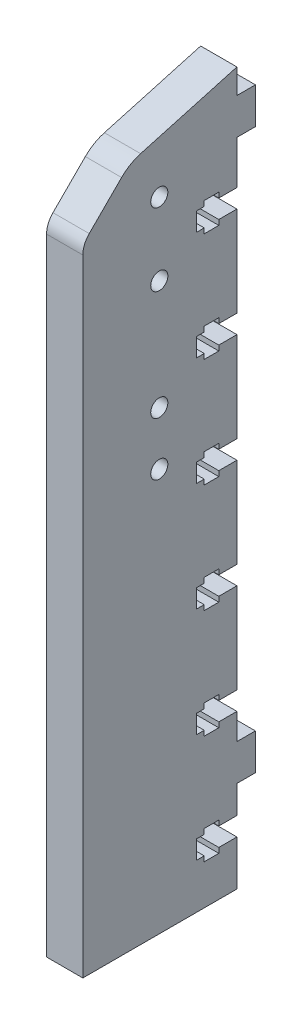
SolidWorks part; units mm, degrees
ref_plane "Front Plane" through (0, 0, 0) normal (0, 0, 1) x (1, 0, 0)
ref_plane "Top Plane" through (0, 0, 0) normal (0, 1, 0) x (1, 0, 0)
ref_plane "Right Plane" through (0, 0, 0) normal (1, 0, 0) x (0, 0, -1)
sketch "Sketch1" plane through (0, 0, 0) normal (0, 0, 1) x (1, 0, 0)
  line L1 (0, 0) -> (-12.7, 0)
  line L2 (0, 0) -> (0, 276.4592)
  line L3 (0, 276.4592) -> (-12.7, 276.4592)
  line L4 (-12.7, 0) -> (-12.7, 276.4592)
  dimension "D1" = 12.7
  dimension "D2" = 276.4592
extrude "Boss-Extrude1" add sketch "Sketch1" along normal blind 53.975
sketch "Sketch2" plane through (0, 0, 0) normal (1, 0, 0) x (0, 0, -1)
  line L0 (0, 276.4592) -> (-53.975, 222.4842)
  line L1 (-53.975, 0) -> (-53.975, 276.4592) construction
  line L2 (-53.975, 222.4842) -> (-53.975, 276.4592)
  line L3 (-53.975, 276.4592) -> (0, 276.4592)
extrude "Cut-Extrude1" cut sketch "Sketch2" against normal through all
fillet "Fillet1" radius 7.62 2 edges at (-6.35, 222.4842, 53.975) (-6.35, 276.4592, 0)
sketch "Sketch4" plane through (-12.7, 0, 0) normal (-1, 0, 0) x (0, 0, 1)
  circle A0 centre (27.1954, 223.5186) radius 3
  circle A1 centre (27.1954, 198.1186) radius 3
  circle A2 centre (27.1954, 159.6376) radius 3
  circle A3 centre (27.1954, 140.9686) radius 3
  dimension "D1" = 6
extrude "Cut-Extrude2" cut sketch "Sketch4" against normal through all
sketch "Sketch6" plane through (-12.7, 0, 0) normal (-1, 0, 0) x (0, 0, 1)
  line L0 (0, 15.8) -> (6.35, 15.8)
  line L1 (6.35, 15.8) -> (6.35, 14)
  line L2 (6.35, 14) -> (11.45, 14)
  line L3 (11.45, 14) -> (11.45, 15.8)
  line L4 (11.45, 15.8) -> (14.224, 15.8)
  line L5 (14.224, 15.8) -> (14.224, 22.3)
  line L6 (14.0078, 15.8) -> (0, 22.3) construction
  line L7 (7.0039, 19.05) -> (98.7784, 19.05) construction
  line L8 (11.45, 22.3) -> (14.224, 22.3)
  line L9 (11.45, 24.1) -> (11.45, 22.3)
  line L10 (6.35, 24.1) -> (11.45, 24.1)
  line L11 (0, 22.3) -> (6.35, 22.3)
  line L12 (6.35, 22.3) -> (6.35, 24.1)
  line L13 (0, 15.8) -> (0, 22.3)
  line L14 (0, 258.0629) -> (0, 0) construction
  line L15 (-6.35, 15.8) -> (0, 15.8) construction
  line L16 (0, 53.9) -> (6.35, 53.9)
  line L17 (6.35, 53.9) -> (6.35, 52.1)
  line L18 (6.35, 52.1) -> (11.45, 52.1)
  line L19 (11.45, 52.1) -> (11.45, 53.9)
  line L20 (14.224, 53.9) -> (14.224, 60.4)
  line L21 (11.45, 60.4) -> (14.224, 60.4)
  line L22 (11.45, 62.2) -> (11.45, 60.4)
  line L23 (6.35, 62.2) -> (11.45, 62.2)
  line L24 (6.35, 60.4) -> (6.35, 62.2)
  line L25 (0, 60.4) -> (6.35, 60.4)
  line L26 (0, 53.9) -> (0, 60.4)
  line L27 (0, 92) -> (6.35, 92)
  line L28 (6.35, 92) -> (6.35, 90.2)
  line L29 (6.35, 90.2) -> (11.45, 90.2)
  line L30 (11.45, 90.2) -> (11.45, 92)
  line L31 (14.224, 92) -> (14.224, 98.5)
  line L32 (11.45, 98.5) -> (14.224, 98.5)
  line L33 (11.45, 100.3) -> (11.45, 98.5)
  line L34 (6.35, 100.3) -> (11.45, 100.3)
  line L35 (6.35, 98.5) -> (6.35, 100.3)
  line L36 (0, 98.5) -> (6.35, 98.5)
  line L37 (0, 92) -> (0, 98.5)
  line L38 (0, 130.1) -> (6.35, 130.1)
  line L39 (6.35, 130.1) -> (6.35, 128.3)
  line L40 (6.35, 128.3) -> (11.45, 128.3)
  line L41 (11.45, 128.3) -> (11.45, 130.1)
  line L42 (14.224, 130.1) -> (14.224, 136.6)
  line L43 (11.45, 136.6) -> (14.224, 136.6)
  line L44 (11.45, 138.4) -> (11.45, 136.6)
  line L45 (6.35, 138.4) -> (11.45, 138.4)
  line L46 (6.35, 136.6) -> (6.35, 138.4)
  line L47 (0, 136.6) -> (6.35, 136.6)
  line L48 (0, 130.1) -> (0, 136.6)
  line L49 (0, 168.2) -> (6.35, 168.2)
  line L50 (6.35, 168.2) -> (6.35, 166.4)
  line L51 (6.35, 166.4) -> (11.45, 166.4)
  line L52 (11.45, 166.4) -> (11.45, 168.2)
  line L53 (14.224, 168.2) -> (14.224, 174.7)
  line L54 (11.45, 174.7) -> (14.224, 174.7)
  line L55 (11.45, 176.5) -> (11.45, 174.7)
  line L56 (6.35, 176.5) -> (11.45, 176.5)
  line L57 (6.35, 174.7) -> (6.35, 176.5)
  line L58 (0, 174.7) -> (6.35, 174.7)
  line L59 (0, 168.2) -> (0, 174.7)
  line L60 (0, 206.3) -> (6.35, 206.3)
  line L61 (6.35, 206.3) -> (6.35, 204.5)
  line L62 (6.35, 204.5) -> (11.45, 204.5)
  line L63 (11.45, 204.5) -> (11.45, 206.3)
  line L64 (14.224, 206.3) -> (14.224, 212.8)
  line L65 (11.45, 212.8) -> (14.224, 212.8)
  line L66 (11.45, 214.6) -> (11.45, 212.8)
  line L67 (6.35, 214.6) -> (11.45, 214.6)
  line L68 (6.35, 212.8) -> (6.35, 214.6)
  line L69 (0, 212.8) -> (6.35, 212.8)
  line L70 (0, 206.3) -> (0, 212.8)
  line L71 (11.45, 53.9) -> (14.224, 53.9)
  line L72 (11.45, 92) -> (14.224, 92)
  line L73 (11.45, 130.1) -> (14.224, 130.1)
  line L74 (11.45, 168.2) -> (14.224, 168.2)
  line L75 (11.45, 206.3) -> (14.224, 206.3)
  point P12 (14.224, 19.05)
  dimension "D1" = 5.05
  dimension "D2" = 5.1
  dimension "D3" = 14.224
  dimension "D4" = 6.5
  dimension "D5" = 6.35
  dimension "D6" = 2.774
  dimension "D8" = 38.1
  dimension "D7" = 6
extrude "Cut-Extrude3" cut sketch "Sketch6" against normal through all
sketch "Sketch7" plane through (-12.7, 0, 0) normal (-1, 0, 0) x (0, 0, 1)
  line L1 (-6.477, 228.04) -> (0, 228.04)
  line L2 (-6.477, 228.04) -> (-6.477, 240.74)
  line L3 (-6.477, 240.74) -> (0, 240.74)
  line L4 (0, 228.04) -> (0, 240.74)
  line L5 (0, 258.0629) -> (0, 212.8) construction
  line L6 (0, 53.9) -> (0, 22.3) construction
  line L7 (-6.477, 32.04) -> (0, 32.04)
  line L8 (-6.477, 32.04) -> (-6.477, 44.74)
  line L9 (-6.477, 44.74) -> (0, 44.74)
  line L10 (0, 32.04) -> (0, 44.74)
  line L12 (6.35, 212.8) -> (0, 212.8) construction
  line L14 (0, 53.9) -> (6.35, 53.9) construction
  dimension "D1" = 15.24
  dimension "D2" = 12.7
  dimension "D3" = 6.477
  dimension "D4" = 9.16
  dimension "D5" = 12.7
  dimension "D6" = 6.477
extrude "Boss-Extrude2" add sketch "Sketch7" against normal blind 12.7
sketch "Sketch8" plane through (-12.7, 0, 0) normal (-1, 0, 0) x (0, 0, 1)
  line L0 (0, 249.4015) -> (37.5764, 238.8828)
  line L1 (0, 258.0629) -> (0, 240.74) construction
  line L2 (51.7432, 224.7161) -> (13.0082, 263.4511) construction
  line L3 (37.5764, 238.8828) -> (0, 279.4)
  line L4 (0, 279.4) -> (0, 249.4015)
  line L5 (53.975, 219.3279) -> (53.975, 0) construction
  dimension "D1" = 16.3986
extrude "Cut-Extrude4" cut sketch "Sketch8" against normal through all
fillet "Fillet2" radius 15.24 1 edges at (-6.35, 238.8828, 37.5764)
